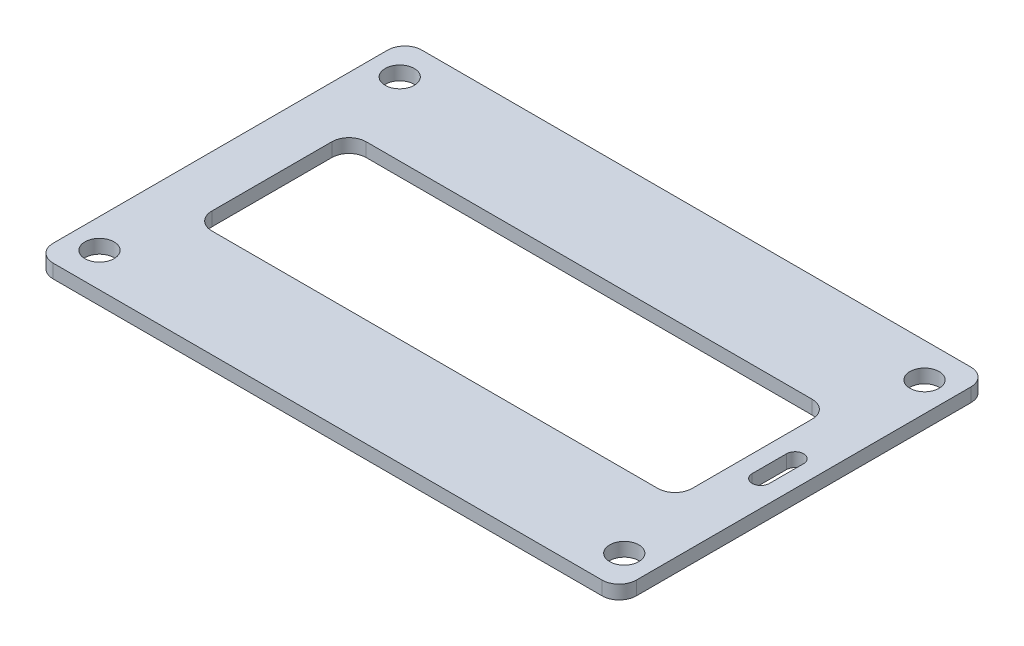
SolidWorks part; units mm, degrees
ref_plane "Front Plane" through (0, 0, 0) normal (0, 0, 1) x (1, 0, 0)
ref_plane "Top Plane" through (0, 0, 0) normal (0, 1, 0) x (1, 0, 0)
ref_plane "Right Plane" through (0, 0, 0) normal (1, 0, 0) x (0, 0, -1)
sketch "Sketch1" plane through (0, 0, 0) normal (0, 1, 0) x (1, 0, 0)
  line L0 (-32, -21.5) -> (32, -21.5) construction
  line L1 (-34, 19.5) -> (-34, -19.5) construction
  line L2 (32, 21.5) -> (-32, 21.5) construction
  line L3 (34, -19.5) -> (34, 19.5) construction
  line L4 (28, -7) -> (28, 7) construction
  line L5 (-26, -9) -> (26, -9) construction
  line L6 (-28, 7) -> (-28, -7) construction
  line L7 (26, 9) -> (-26, 9) construction
  line L8 (-32, -21.5) -> (32, -21.5)
  line L9 (-34, 19.5) -> (-34, -19.5)
  line L10 (32, 21.5) -> (-32, 21.5)
  line L11 (34, -19.5) -> (34, 19.5)
  line L12 (28, -7) -> (28, 7)
  line L13 (-26, -9) -> (26, -9)
  line L14 (-28, 7) -> (-28, -7)
  line L15 (26, 9) -> (-26, 9)
  line L16 (30, 2) -> (30, -2) construction
  line L17 (30, 2) -> (30, -2)
  line L18 (32, -2) -> (32, 2) construction
  line L19 (32, -2) -> (32, 2)
  circle A1 centre (30.5885, 17.5) radius 1.7 construction
  circle A2 centre (-30.5885, 17.5) radius 1.7 construction
  circle A3 centre (-30.5885, -17.5) radius 1.7 construction
  circle A4 centre (30.5885, -17.5) radius 1.7 construction
  arc A5 (32, -21.5) -> (34, -19.5) centre (32, -19.5) ccw construction
  arc A6 (-34, -19.5) -> (-32, -21.5) centre (-32, -19.5) ccw construction
  arc A7 (-32, 21.5) -> (-34, 19.5) centre (-32, 19.5) ccw construction
  arc A8 (34, 19.5) -> (32, 21.5) centre (32, 19.5) ccw construction
  arc A9 (28, 7) -> (26, 9) centre (26, 7) ccw construction
  arc A10 (26, -9) -> (28, -7) centre (26, -7) ccw construction
  arc A11 (-28, -7) -> (-26, -9) centre (-26, -7) ccw construction
  arc A12 (-26, 9) -> (-28, 7) centre (-26, 7) ccw construction
  circle A14 centre (30.5885, 17.5) radius 1.7
  circle A15 centre (-30.5885, 17.5) radius 1.7
  circle A16 centre (-30.5885, -17.5) radius 1.7
  circle A17 centre (30.5885, -17.5) radius 1.7
  arc A18 (32, -21.5) -> (34, -19.5) centre (32, -19.5) ccw
  arc A19 (-34, -19.5) -> (-32, -21.5) centre (-32, -19.5) ccw
  arc A20 (-32, 21.5) -> (-34, 19.5) centre (-32, 19.5) ccw
  arc A21 (34, 19.5) -> (32, 21.5) centre (32, 19.5) ccw
  arc A22 (28, 7) -> (26, 9) centre (26, 7) ccw
  arc A23 (26, -9) -> (28, -7) centre (26, -7) ccw
  arc A24 (-28, -7) -> (-26, -9) centre (-26, -7) ccw
  arc A25 (-26, 9) -> (-28, 7) centre (-26, 7) ccw
  arc A26 (32, 2) -> (30, 2) centre (31, 2) ccw construction
  arc A27 (32, 2) -> (30, 2) centre (31, 2) ccw
  arc A28 (30, -2) -> (32, -2) centre (31, -2) ccw construction
  arc A29 (30, -2) -> (32, -2) centre (31, -2) ccw
extrude "Boss-Extrude1" add sketch "Sketch1" along normal blind 1.6
